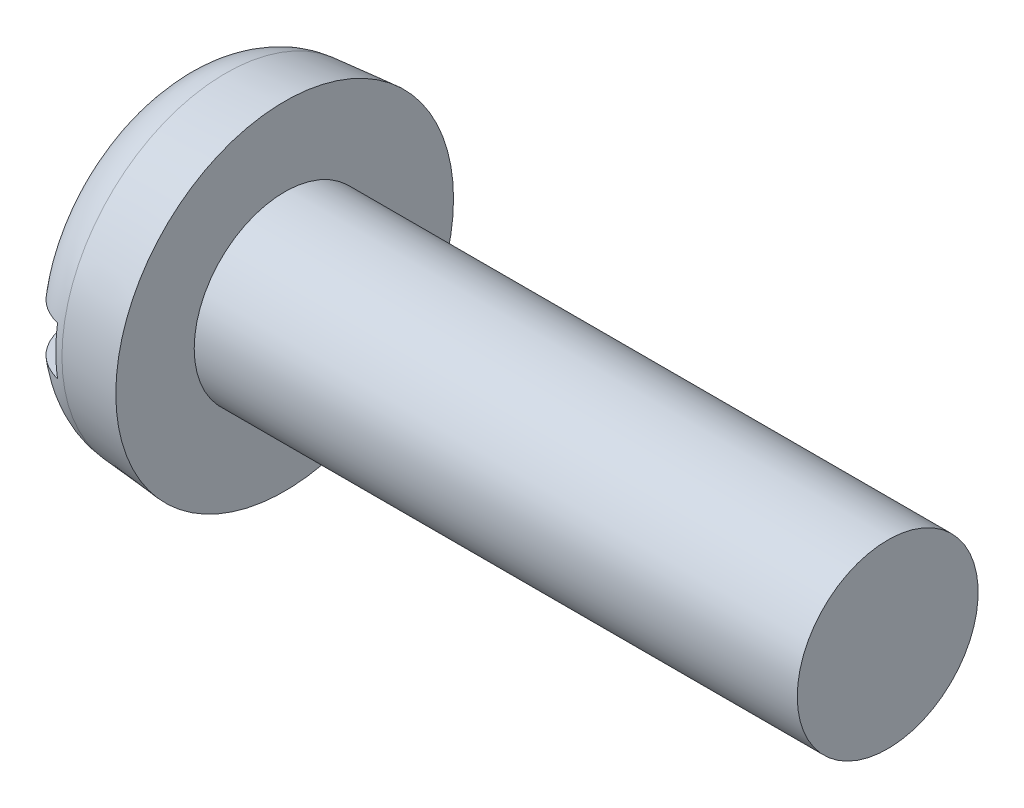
SolidWorks part; units mm, degrees
ref_plane "Plane1" through (0, 0, 0) normal (0, 0, 1) x (1, 0, 0)
ref_plane "Plane2" through (0, 0, 0) normal (0, 1, 0) x (1, 0, 0)
ref_plane "Plane3" through (0, 0, 0) normal (1, 0, 0) x (0, 0, -1)
sketch "BodySke" plane through (0, 0, 0) normal (0, 0, 1) x (1, 0, 0)
  line L0 (1.8, 1.5) -> (1.8, 2.8)
  line L1 (0, 0) -> (0, 2.6425)
  line L2 (-25.4, 0) -> (127, 0) construction
  line L3 (11.8, 0) -> (0, 0)
  line L4 (1.8, 1.5) -> (11.8, 1.5)
  line L5 (11.8, 1.5) -> (11.8, 0)
  line L6 (0, 2.6425) -> (1.8, 2.8)
  line L9 (2.3, 3.0875) -> (2.3, -6.4375) construction
  line L10 (1.8, 6.35) -> (1.8, -3.175) construction
revolve "Base-Revolve" add sketch "BodySke"
fillet "Fillet1" [suppressed] radius 0.1
fillet "Fillet2" radius 0.9 1 edges at (0, 0, 2.6425)
sketch "Sketch2" plane through (0, 0, 0) normal (1, 0, 0) x (0, 0, -1)
  line L0 (2.8, -0.4) -> (-2.8, -0.4)
  line L1 (2.8, -0.4) -> (2.8, 0.4)
  line L2 (-2.8, 0.4) -> (2.8, 0.4)
  line L3 (-2.8, 0.4) -> (-2.8, -0.4)
extrude "Slot" cut sketch "Sketch2" along normal blind 0.7
sketch "ThdSchSke" plane through (0, 0, 0) normal (0, 0, 1) x (1, 0, 0)
  line L0 (2.8, -1.2195) -> (2.6036, -1.5)
  line L1 (2.8, -1.2195) -> (2.9964, -1.5)
  line L2 (2.9964, -1.5) -> (2.9964, -1.875)
  line L3 (-3.175, 0) -> (5.1513, 0) construction
  line L5 (2.9964, -1.875) -> (2.6036, -1.875)
  line L6 (2.6036, -1.875) -> (2.6036, -1.5)
revolve "ThreadSchematic" [suppressed] cut sketch "ThdSchSke" angle 360 about L3
pattern_linear "ThdSchPat" [suppressed]
equation "\"D1@Sketch2\" = \"Head_dia@BodySke\""
equation "\"D2@Sketch2\" = \"D1@Sketch2\" / 2"
equation "\"D3@Sketch2\" = \"Slot_width@Sketch2\" / 2"
equation "\"Thread_length@ThreadCosmetic\" = ((sgn( (\"Length@BodySke\" - \"Advance@BodySke\" * 2.0 ) - \"Thread_nom@BodySke\" )-1)*( (\"Length@BodySke\" - \"Advance@BodySke\"  * 2.0) - \"Thread_nom@BodySke\" ))/-2+ \"Thread_"
equation "\"Thread_minor@ThdSchSke\" = \"Thread_minor@ThreadCosmetic\""
equation "\"Diameter@ThdSchSke\" = \"Diameter@BodySke\""
equation "\"Overcut@ThdSchSke\" = \"Diameter@BodySke\" * 1.25"
equation "\"Start@ThdSchSke\" = \"Head_ht@BodySke\" + \"Length@BodySke\" - \"Thread_length@ThreadCosmetic\"  '---Non-countersunk---"
equation "\"Num_threads@ThdSchPat\" = int( \"Thread_length@ThreadCosmetic\" / \"Advance@BodySke\" + 0.999 )  + 1"
equation "\"Advance@ThdSchPat\" = \"Thread_length@ThreadCosmetic\" /  (\"Num_threads@ThdSchPat\" - 1) 'relax it"
